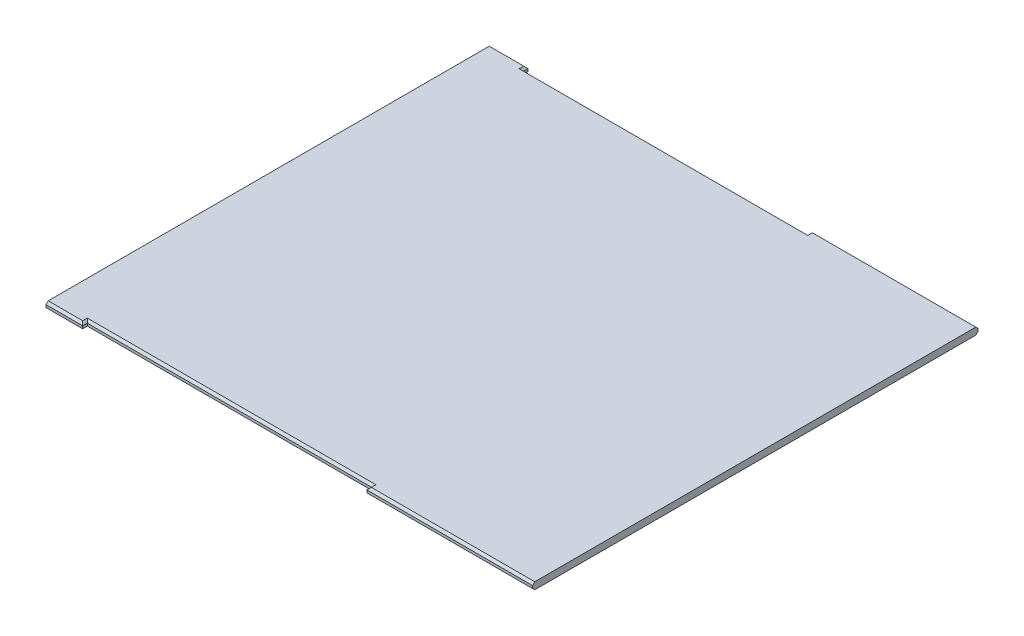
SolidWorks part; units mm, degrees
ref_plane "Front Plane" through (0, 0, 0) normal (1, 0, 0) x (0, 1, 0)
ref_plane "Top Plane" through (0, 0, 0) normal (0, 0, 1) x (0, 1, 0)
ref_plane "Right Plane" through (0, 0, 0) normal (0, 1, 0) x (-1, 0, 0)
sketch "Sketch2"
sketch_block_instance "Block4-1"
sketch_block "Block4"
extrude "Boss-Extrude2" add sketch "Sketch2" along normal mid plane 19.05
chamfer "Chamfer1" distance 6 angle 45 20 edges at (-612.5735, -9.525, -568.6517) (-562.5735, -9.525, -562.3892) (-175.5735, -9.525, -556.1267) (211.4265, -9.525, -562.3892) (437.0265, -9.525, -568.6517) (-612.5735, 9.525, -568.6517) (-562.5735, 9.525, -562.3892) (-175.5735, 9.525, -556.1267) (437.0265, 9.525, -568.6517) (211.4265, 9.525, -562.3892) (-612.5735, -9.525, 644.5483) (-562.5735, -9.525, 638.2858) (-175.5735, -9.525, 632.0233) (211.4265, -9.525, 638.2858) (437.0265, -9.525, 644.5483) (-612.5735, 9.525, 644.5483) (-562.5735, 9.525, 638.2858) (-175.5735, 9.525, 632.0233) (211.4265, 9.525, 638.2858) (437.0265, 9.525, 644.5483)
